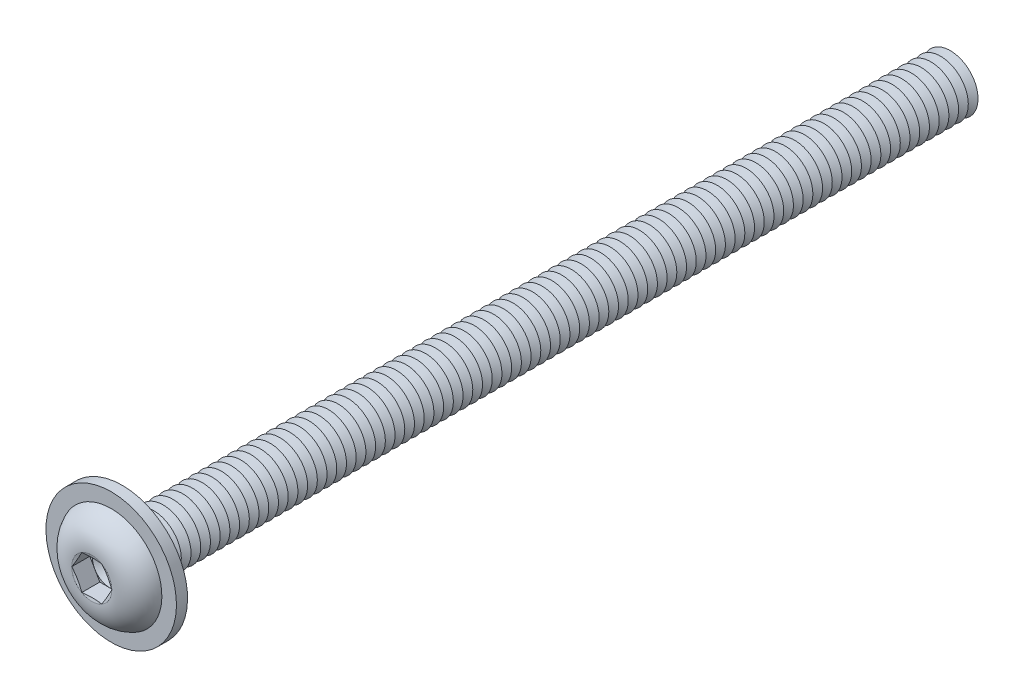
SolidWorks part; units mm, degrees
ref_plane "Front Plane" through (0, 0, 0) normal (0, 0, 1) x (1, 0, 0)
ref_plane "Top Plane" through (0, 0, 0) normal (0, 1, 0) x (1, 0, 0)
ref_plane "Right Plane" through (0, 0, 0) normal (1, 0, 0) x (0, 0, -1)
sketch "Sketch1" plane through (0, 0, 0) normal (1, 0, 0) x (0, 0, -1)
  line L0 (0, 2) -> (0, 3.8)
  line L3 (0, 2) -> (60, 2)
  line L4 (60, 2) -> (60, 0)
  line L5 (60, 0) -> (-2.2, 0) construction
  line L6 (-2.2, 0) -> (60, 0)
  line L7 (-2.2, 1.4434) -> (-2.2, 0.7217) construction
  line L8 (-2.2, 0.7217) -> (-2.2, 0)
  line L9 (-2.2, 1.4434) -> (-2.0066, 0.7217)
  line L10 (-2.0066, 0.7217) -> (-2.2, 0.7217)
  line L11 (60, 0) -> (22.7481, 0) construction
  line L12 (0, 3.8) -> (-2.2, 3.8) construction
  arc A1 (0, 3.8) -> (-2.2, 1.4434) centre (0, 1.5948) ccw
  point P8 (60, 1)
  dimension "D1" = 7.6
  dimension "D2" = 4
  dimension "D3" = 2.2
  dimension "D4" = 2.8868
  dimension "D5" = 60
  dimension "D6" = 15
revolve "Revolve1" add sketch "Sketch1" angle 360 about L5
fillet "Fillet1" radius 0.35 1 edges at (0, 2, 0)
sketch "Sketch2" plane through (0, 0, 0) normal (1, 0, 0) x (0, 0, -1)
  line L0 (59.65, 2) -> (60.35, 2)
  line L1 (60, 2) -> (0.35, 2) construction
  line L2 (60.35, 2) -> (60, 1.3938)
  line L3 (60, -2) -> (60, 2) construction
  line L4 (60, 1.3938) -> (59.65, 2)
  dimension "D1" = 0.7
revolve "Cut-Revolve1" cut sketch "Sketch2" angle 360 about axis through (0, 0, -60) along (0, 0, -1)
pattern_linear "LPattern1" count 85 spacing 0.7 along (0, 0, 1) of "Cut-Revolve1"
sketch "Sketch3" plane through (0, 0, 2.2) normal (0, 0, 1) x (1, 0, 0)
  line L7 (0.7217, 1.25) -> (-0.7217, 1.25)
  line L8 (-0.7217, 1.25) -> (-1.4434, 0)
  line L9 (-1.4434, 0) -> (-0.7217, -1.25)
  line L10 (-0.7217, -1.25) -> (0.7217, -1.25)
  line L11 (0.7217, -1.25) -> (1.4434, 0)
  line L12 (1.4434, 0) -> (0.7217, 1.25)
  circle A0 centre (0, 0) radius 1.25 construction
  circle A3 centre (0, 0) radius 1.4434 construction
extrude "Cut-Extrude1" cut sketch "Sketch3" against normal blind 1.3
sketch "Sketch4" plane through (0, 0, 0.9) normal (0, 0, 1) x (1, 0, 0)
  line L1 (0.7217, 1.25) -> (-0.7217, 1.25) construction
  circle A0 centre (0, 0) radius 1.25
extrude "Cut-Extrude2" cut sketch "Sketch4" against normal through all draft 60
sketch "Sketch5" plane through (0, 0, 0) normal (0, 0, -1) x (-1, 0, 0)
  circle A0 centre (0, 0) radius 4.7
  circle A1 centre (0, 0) radius 2.35
  circle A2 centre (0, 0) radius 2.35 construction
  dimension "D1" = 9.4
extrude "Boss-Extrude1" add sketch "Sketch5" against normal blind 0.8
